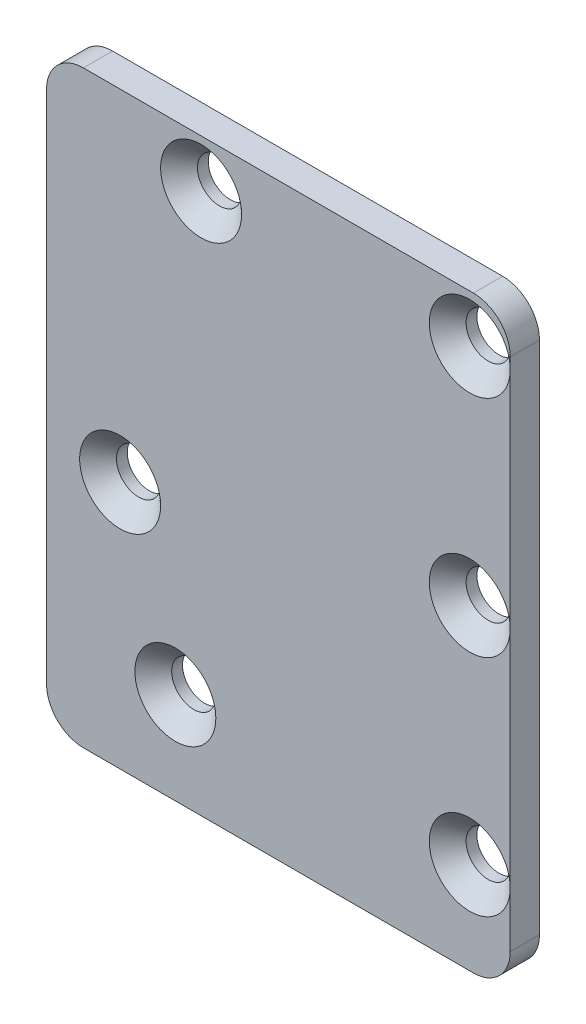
SolidWorks part; units mm, degrees
ref_plane "Front Plane" through (0, 0, 0) normal (0, 0, 1) x (1, 0, 0)
ref_plane "Top Plane" through (0, 0, 0) normal (0, 1, 0) x (1, 0, 0)
ref_plane "Right Plane" through (0, 0, 0) normal (1, 0, 0) x (0, 0, -1)
sketch "Sketch1" plane through (0, 0, 0) normal (0, 0, 1) x (1, 0, 0)
  line L1 (0, 0) -> (25.2, 0)
  line L2 (0, 0) -> (0, 32)
  line L3 (0, 32) -> (25.2, 32)
  line L4 (25.2, 0) -> (25.2, 32)
  dimension "D1" = 32
  dimension "D2" = 25.2
extrude "Boss-Extrude1" add sketch "Sketch1" along normal blind 1.5875
hole_wizard "CSK for M2 Flat Head Machine Screw1" positions "Sketch3" profile "Sketch2" countersink size "M2" standard "Ansi Metric"
sketch "Sketch3" plane through (0, 0, 1.5875) normal (0, 0, 1) x (1, 0, 0)
  line L0 (0, -0.8731) -> (0, 0.8731) construction
  line L2 (25.2, 32) -> (0, 32) construction
  point P0 (7, 5)
  point P6 (23, 5)
  point P8 (23, 17.2)
  point P10 (23, 29.4)
  point P12 (4, 13.5)
  point P14 (8.4, 29.4)
  dimension "D1" = 7
  dimension "D2" = 2.6
  dimension "D3" = 23
  dimension "D4" = 12.2
  dimension "D5" = 12.2
  dimension "D6" = 18.5
  dimension "D7" = 4
  dimension "D8" = 8.4
  dimension "D9" = 27
  dimension "D10" = 2.6
sketch "Sketch2" plane through (7, 5, 1.5875) normal (1, 0, 0) x (0, -1, 0)
  line L0 (0, 0) -> (0, 1.5875)
  line L1 (0, 1.5875) -> (1.2, 1.5875)
  line L2 (1.2, 1.5875) -> (1.2, 1)
  line L3 (1.2, 1) -> (2.2, 0)
  line L5 (2.2, 0) -> (0, 0)
  line L6 (-1.2, 1) -> (-2.2, 0) construction
  line L11 (0, -6.35) -> (0, 107.95) construction
  dimension "Thru Hole Dia." = 2.4
  dimension "Thru Hole Depth" = 1.5875
  dimension "Near C'Sink Dia." = 4.4
  dimension "Near C'Sink Angle" = 90
sketch "Sketch4" plane through (0, 0, 0) normal (0, 0, -1) x (-1, 0, 0)
  line L0 (-18.15, 15.7) -> (-5.35, 25.8) construction
  line L1 (-18.4597, 16.0925) -> (-5.6597, 26.1925)
  line L2 (-17.8403, 15.3075) -> (-5.0403, 25.4075)
  line L3 (-25.2, 32) -> (0, 32) construction
  line L9 (0, 0.8731) -> (0, -0.8731) construction
  line L11 (-2.35, 21.2) -> (-18.15, 5.7) construction
  line L12 (-1.9999, 20.8431) -> (-17.7999, 5.3431)
  line L13 (-2.7001, 21.5569) -> (-18.5001, 6.0569)
  arc A0 (-18.4597, 16.0925) -> (-17.8403, 15.3075) centre (-18.15, 15.7) ccw
  arc A1 (-5.0403, 25.4075) -> (-5.6597, 26.1925) centre (-5.35, 25.8) ccw
  arc A7 (-1.9999, 20.8431) -> (-2.7001, 21.5569) centre (-2.35, 21.2) ccw
  arc A8 (-18.5001, 6.0569) -> (-17.7999, 5.3431) centre (-18.15, 5.7) ccw
  point P2 (-11.75, 20.75)
  point P9 (-10.25, 13.45)
  dimension "D1" = 0.5
  dimension "D9" = 0.5
  dimension "D2" = 18.15
  dimension "D3" = 10.8
  dimension "D4" = 2.35
  dimension "D5" = 6.2
  dimension "D6" = 26.3
  dimension "D7" = 18.15
  dimension "D8" = 5.35
  dimension "D10" = 16.3
sketch "Sketch5" plane through (0, 0, 0) normal (0, 0, -1) x (-1, 0, 0)
  line L0 (-18.15, 15.7) -> (-5.35, 25.8) construction
  line L1 (-18.6456, 16.328) -> (-5.8456, 26.428)
  line L2 (-17.6544, 15.072) -> (-4.8544, 25.172)
  line L3 (-5.35, 25.8) -> (-18.15, 15.7) construction
  line L4 (-4.1111, 24.2299) -> (-16.9111, 14.1299)
  line L5 (-6.5889, 27.3701) -> (-19.3889, 17.2701)
  line L6 (-18.15, 5.7) -> (-2.35, 21.2) construction
  line L7 (-18.7102, 6.2711) -> (-2.9102, 21.7711)
  line L8 (-17.5898, 5.1289) -> (-1.7898, 20.6289)
  line L9 (-2.35, 21.2) -> (-18.15, 5.7) construction
  line L10 (-0.9494, 19.7723) -> (-16.7494, 4.2723)
  line L11 (-3.7506, 22.6277) -> (-19.5506, 7.1277)
  arc A0 (-18.6456, 16.328) -> (-17.6544, 15.072) centre (-18.15, 15.7) ccw
  arc A1 (-4.8544, 25.172) -> (-5.8456, 26.428) centre (-5.35, 25.8) ccw
  arc A3 (-4.1111, 24.2299) -> (-6.5889, 27.3701) centre (-5.35, 25.8) ccw
  arc A4 (-18.7102, 6.2711) -> (-17.5898, 5.1289) centre (-18.15, 5.7) ccw
  arc A5 (-1.7898, 20.6289) -> (-2.9102, 21.7711) centre (-2.35, 21.2) ccw
  arc A6 (-0.9494, 19.7723) -> (-3.7506, 22.6277) centre (-2.35, 21.2) ccw
  arc A7 (-19.5506, 7.1277) -> (-16.7494, 4.2723) centre (-18.15, 5.7) ccw
  arc A8 (-19.3889, 17.2701) -> (-16.9111, 14.1299) centre (-18.15, 15.7) ccw
  point P2 (-11.75, 20.75)
  point P8 (-11.75, 20.75)
  point P17 (-10.25, 13.45)
  point P22 (-10.25, 13.45)
  dimension "D1" = 2
  dimension "D2" = 2
  dimension "D3" = 0.8
  dimension "D4" = 0.8
extrude "Cut-Extrude2" cut sketch "Sketch5" against normal blind 0.75
fillet "Fillet1" radius 2 4 edges at (0, 32, 0.7937) (25.2, 32, 0.7937) (0, 0, 0.7937) (25.2, 0, 0.7937)
sketch "Sketch6" plane through (0, 0, 0) normal (0, 0, -1) x (-1, 0, 0)
  circle A0 centre (-23, 5) radius 1.2 construction
  circle A1 centre (-23, 17.2) radius 1.2 construction
  circle A2 centre (-23, 29.4) radius 1.2 construction
  circle A3 centre (-8.4, 29.4) radius 1.2 construction
  circle A4 centre (-4, 13.5) radius 1.2 construction
  circle A5 centre (-7, 5) radius 1.2 construction
  circle A6 centre (-23, 5) radius 1.2
  circle A7 centre (-23, 17.2) radius 1.2
  circle A8 centre (-23, 29.4) radius 1.2
  circle A9 centre (-8.4, 29.4) radius 1.2
  circle A10 centre (-4, 13.5) radius 1.2
  circle A11 centre (-7, 5) radius 1.2
sketch "Sketch7" [suppressed] plane through (0, 0, 0) normal (0, 0, -1) x (-1, 0, 0)
  line L0 (-4.6971, 25.2369) -> (-19.3471, 5.1369) construction
  line L1 (-15.9529, 2.6631) -> (-1.3029, 22.7631) construction
  line L2 (-16.0075, 12.5914) -> (-8.7575, 21.6914) construction
  line L3 (-12.0425, 24.3086) -> (-19.2925, 15.2086) construction
  line L4 (-4.6971, 25.2369) -> (-19.3471, 5.1369)
  line L5 (-15.9529, 2.6631) -> (-1.3029, 22.7631)
  line L6 (-16.0075, 12.5914) -> (-8.7575, 21.6914)
  line L7 (-12.0425, 24.3086) -> (-19.2925, 15.2086)
  line L8 (-3.6465, 24.4712) -> (-18.2965, 4.3712) construction
  line L9 (-17.0035, 3.4288) -> (-2.3535, 23.5288) construction
  line L10 (-11.0257, 23.4985) -> (-18.2757, 14.3985) construction
  line L11 (-17.0243, 13.4015) -> (-9.7743, 22.5015) construction
  line L12 (-3.6465, 24.4712) -> (-18.2965, 4.3712)
  line L13 (-17.0035, 3.4288) -> (-2.3535, 23.5288)
  line L14 (-11.0257, 23.4985) -> (-18.2757, 14.3985)
  line L15 (-17.0243, 13.4015) -> (-9.7743, 22.5015)
  arc A0 (-1.3029, 22.7631) -> (-4.6971, 25.2369) centre (-3, 24) ccw construction
  arc A1 (-19.3471, 5.1369) -> (-15.9529, 2.6631) centre (-17.65, 3.9) ccw construction
  arc A2 (-19.2925, 15.2086) -> (-16.0075, 12.5914) centre (-17.65, 13.9) ccw construction
  arc A3 (-8.7575, 21.6914) -> (-12.0425, 24.3086) centre (-10.4, 23) ccw construction
  arc A4 (-1.3029, 22.7631) -> (-4.6971, 25.2369) centre (-3, 24) ccw
  arc A5 (-19.3471, 5.1369) -> (-15.9529, 2.6631) centre (-17.65, 3.9) ccw
  arc A6 (-19.2925, 15.2086) -> (-16.0075, 12.5914) centre (-17.65, 13.9) ccw
  arc A7 (-8.7575, 21.6914) -> (-12.0425, 24.3086) centre (-10.4, 23) ccw
  arc A8 (-18.2965, 4.3712) -> (-17.0035, 3.4288) centre (-17.65, 3.9) ccw construction
  arc A9 (-2.3535, 23.5288) -> (-3.6465, 24.4712) centre (-3, 24) ccw construction
  arc A10 (-18.2757, 14.3985) -> (-17.0243, 13.4015) centre (-17.65, 13.9) ccw construction
  arc A11 (-9.7743, 22.5015) -> (-11.0257, 23.4985) centre (-10.4, 23) ccw construction
  arc A12 (-18.2965, 4.3712) -> (-17.0035, 3.4288) centre (-17.65, 3.9) ccw
  arc A13 (-2.3535, 23.5288) -> (-3.6465, 24.4712) centre (-3, 24) ccw
  arc A14 (-18.2757, 14.3985) -> (-17.0243, 13.4015) centre (-17.65, 13.9) ccw
  arc A15 (-9.7743, 22.5015) -> (-11.0257, 23.4985) centre (-10.4, 23) ccw
sketch "Sketch8" [suppressed] plane through (0, 0, 0) normal (0, 0, -1) x (-1, 0, 0)
  line L0 (-3.4662, 38.7807) -> (-11.2162, 18.7807) construction
  line L1 (-10.2838, 18.4193) -> (-2.5338, 38.4193) construction
  line L2 (-17.2606, 28.2863) -> (-10.0106, 37.2863) construction
  line L3 (-10.7894, 37.9137) -> (-18.0394, 28.9137) construction
  line L4 (-3.4662, 38.7807) -> (-11.2162, 18.7807)
  line L5 (-10.2838, 18.4193) -> (-2.5338, 38.4193)
  line L6 (-17.2606, 28.2863) -> (-10.0106, 37.2863)
  line L7 (-10.7894, 37.9137) -> (-18.0394, 28.9137)
  arc A0 (-11.2162, 18.7807) -> (-10.2838, 18.4193) centre (-10.75, 18.6) ccw construction
  arc A1 (-2.5338, 38.4193) -> (-3.4662, 38.7807) centre (-3, 38.6) ccw construction
  arc A2 (-10.0106, 37.2863) -> (-10.7894, 37.9137) centre (-10.4, 37.6) ccw construction
  arc A3 (-18.0394, 28.9137) -> (-17.2606, 28.2863) centre (-17.65, 28.6) ccw construction
  arc A4 (-11.2162, 18.7807) -> (-10.2838, 18.4193) centre (-10.75, 18.6) ccw
  arc A5 (-2.5338, 38.4193) -> (-3.4662, 38.7807) centre (-3, 38.6) ccw
  arc A6 (-10.0106, 37.2863) -> (-10.7894, 37.9137) centre (-10.4, 37.6) ccw
  arc A7 (-18.0394, 28.9137) -> (-17.2606, 28.2863) centre (-17.65, 28.6) ccw
ref_plane "Plane1" through (0, 2, 1.5875) normal (0, -1, 0) x (-1, 0, 0)
sketch "Sketch10" plane through (0, 0, 1.5875) normal (0, 0, 1) x (1, 0, 0)
  line L1 (-8.6617, -9.0863) -> (38.998, -9.0863)
  line L2 (-8.6617, -9.0863) -> (-8.6617, 42.4409)
  line L3 (-8.6617, 42.4409) -> (38.998, 42.4409)
  line L4 (38.998, -9.0863) -> (38.998, 42.4409)
sketch "Sketch11" plane through (0, 0, 1.5875) normal (0, 0, 1) x (1, 0, 0)
  line L0 (2, 0) -> (23.2, 0) construction
  line L1 (-6.4516, -10.287) -> (31.6484, -10.287)
  line L2 (-6.4516, -10.287) -> (-6.4516, 42.291)
  line L3 (-6.4516, 42.291) -> (31.6484, 42.291)
  line L4 (31.6484, -10.287) -> (31.6484, 42.291)
  line L5 (0, 30) -> (0, 2) construction
  dimension "D1" = 38.1
  dimension "D2" = 52.578
  dimension "D3" = 10.287
  dimension "D4" = 6.4516
